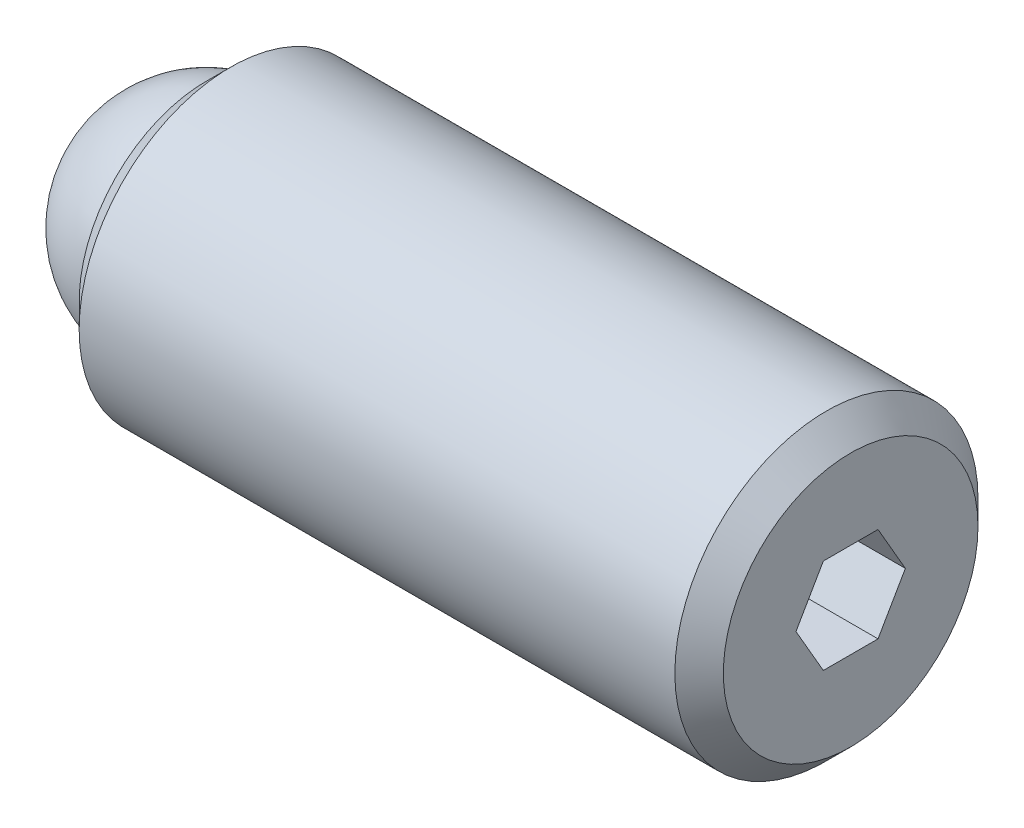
SolidWorks part; units mm, degrees
ref_plane "Front Plane" through (0, 0, 0) normal (0, 0, 1) x (1, 0, 0)
ref_plane "Top Plane" through (0, 0, 0) normal (0, 1, 0) x (1, 0, 0)
ref_plane "Right Plane" through (0, 0, 0) normal (1, 0, 0) x (0, 0, -1)
sketch "Sketch2" plane through (0, 0, 0) normal (1, 0, 0) x (0, 0, -1)
  circle A0 centre (0, 0) radius 3.175
  dimension "D1" = 6.35
extrude "Boss-Extrude1" add sketch "Sketch2" along normal blind 13.4937
sketch "Sketch3" plane through (0, 0, 0) normal (-1, 0, 0) x (0, 0, 1)
  circle A0 centre (0, 0) radius 2.3813
  dimension "D1" = 4.7625
chamfer "Chamfer1" distance 0.508 angle 45 1 edges at (0, 0, -3.175)
chamfer "Chamfer2" distance 0.508 angle 45 1 edges at (13.4937, 0, -3.175)
sketch "Sketch4" plane through (13.4937, 0, 0) normal (1, 0, 0) x (0, 0, -1)
  line L1 (1.1457, 0) -> (0.5728, 0.9922)
  line L2 (0.5728, 0.9922) -> (-0.5728, 0.9922)
  line L3 (-0.5728, 0.9922) -> (-1.1457, 0)
  line L4 (-1.1457, 0) -> (-0.5728, -0.9922)
  line L5 (-0.5728, -0.9922) -> (0.5728, -0.9922)
  line L6 (0.5728, -0.9922) -> (1.1457, 0)
  circle A0 centre (0, 0) radius 0.9922 construction
  dimension "D1" = 1.9844
extrude "Cut-Extrude2" cut sketch "Sketch4" against normal blind 2.286
extrude "Cut-Extrude3" cut sketch "Sketch3" against normal blind 1.9844
sketch "Sketch5" plane through (0, 0, 0) normal (-1, 0, 0) x (0, 0, 1)
  line L0 (0, 0) -> (0, -2.3813)
  line L1 (0, 0) -> (0, 2.3813)
  arc A0 (0, 2.3813) -> (0, -2.3813) centre (0, 0) ccw
  dimension "D1" = 2.3813
revolve "Revolve1" add sketch "Sketch5" angle 360 about L1
